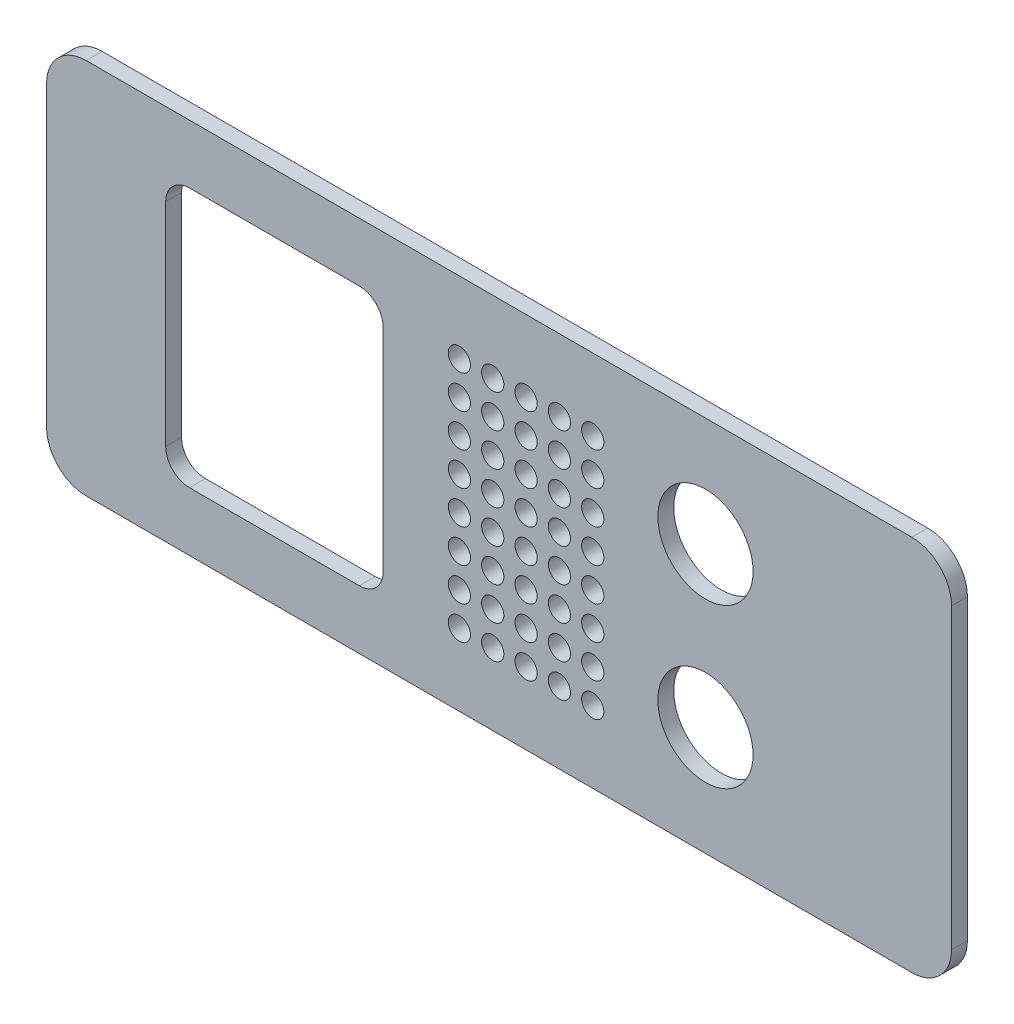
SolidWorks part; units mm, degrees
ref_plane "Front Plane" through (0, 0, 0) normal (0, 0, 1) x (1, 0, 0)
ref_plane "Top Plane" through (0, 0, 0) normal (0, 1, 0) x (1, 0, 0)
ref_plane "Right Plane" through (0, 0, 0) normal (1, 0, 0) x (0, 0, -1)
sketch "Sketch1" plane through (0, 0, 0) normal (0, 0, 1) x (1, 0, 0)
  line L0 (26, 21.275) -> (26, -20.3317) construction
  line L1 (-52, 23.75) -> (52, 23.75)
  line L2 (-57, 18.75) -> (-57, -18.75)
  line L3 (-52, -23.75) -> (52, -23.75)
  line L4 (57, 18.75) -> (57, -18.75)
  line L5 (-57, 23.75) -> (57, -23.75) construction
  line L6 (-57, -23.75) -> (57, 23.75) construction
  line L7 (-39, 16.35) -> (-17.6, 16.35)
  line L8 (-42, 13.35) -> (-42, -13.35)
  line L9 (-39, -16.35) -> (-17.6, -16.35)
  line L10 (-14.6, 13.35) -> (-14.6, -13.35)
  line L11 (-42, 16.35) -> (-14.6, -16.35) construction
  line L12 (-42, -16.35) -> (-14.6, 16.35) construction
  line L13 (-45.2, 19.4) -> (-11.4, 19.4) construction
  line L14 (-45.2, 19.4) -> (-45.2, -19.4) construction
  line L15 (-45.2, -19.4) -> (-11.4, -19.4) construction
  line L16 (-11.4, 19.4) -> (-11.4, -19.4) construction
  line L17 (-45.2, 19.4) -> (-11.4, -19.4) construction
  line L18 (-45.2, -19.4) -> (-11.4, 19.4) construction
  arc A0 (-57, -18.75) -> (-52, -23.75) centre (-52, -18.75) ccw
  arc A1 (52, -23.75) -> (57, -18.75) centre (52, -18.75) ccw
  arc A2 (52, 23.75) -> (57, 18.75) centre (52, 18.75) cw
  arc A3 (-52, 23.75) -> (-57, 18.75) centre (-52, 18.75) ccw
  circle A4 centre (-5, -14.7) radius 1.4
  circle A5 centre (-0.8, -14.7) radius 1.4
  circle A6 centre (3.4, -14.7) radius 1.4
  circle A7 centre (7.6, -14.7) radius 1.4
  circle A8 centre (11.8, -14.7) radius 1.4
  circle A9 centre (-5, -10.5) radius 1.4
  circle A10 centre (-0.8, -10.5) radius 1.4
  circle A11 centre (3.4, -10.5) radius 1.4
  circle A12 centre (7.6, -10.5) radius 1.4
  circle A13 centre (11.8, -10.5) radius 1.4
  circle A14 centre (-5, -6.3) radius 1.4
  circle A15 centre (-0.8, -6.3) radius 1.4
  circle A16 centre (3.4, -6.3) radius 1.4
  circle A17 centre (7.6, -6.3) radius 1.4
  circle A18 centre (11.8, -6.3) radius 1.4
  circle A19 centre (-5, -2.1) radius 1.4
  circle A20 centre (-0.8, -2.1) radius 1.4
  circle A21 centre (3.4, -2.1) radius 1.4
  circle A22 centre (7.6, -2.1) radius 1.4
  circle A23 centre (11.8, -2.1) radius 1.4
  circle A24 centre (-5, 2.1) radius 1.4
  circle A25 centre (-0.8, 2.1) radius 1.4
  circle A26 centre (3.4, 2.1) radius 1.4
  circle A27 centre (7.6, 2.1) radius 1.4
  circle A28 centre (11.8, 2.1) radius 1.4
  circle A29 centre (-5, 6.3) radius 1.4
  circle A30 centre (-0.8, 6.3) radius 1.4
  circle A31 centre (3.4, 6.3) radius 1.4
  circle A32 centre (7.6, 6.3) radius 1.4
  circle A33 centre (11.8, 6.3) radius 1.4
  circle A34 centre (-5, 10.5) radius 1.4
  circle A35 centre (-0.8, 10.5) radius 1.4
  circle A36 centre (3.4, 10.5) radius 1.4
  circle A37 centre (7.6, 10.5) radius 1.4
  circle A38 centre (11.8, 10.5) radius 1.4
  circle A39 centre (-5, 14.7) radius 1.4
  circle A40 centre (-0.8, 14.7) radius 1.4
  circle A41 centre (3.4, 14.7) radius 1.4
  circle A42 centre (7.6, 14.7) radius 1.4
  circle A43 centre (11.8, 14.7) radius 1.4
  arc A44 (-17.6, -16.35) -> (-14.6, -13.35) centre (-17.6, -13.35) ccw
  arc A45 (-42, -13.35) -> (-39, -16.35) centre (-39, -13.35) ccw
  arc A46 (-17.6, 16.35) -> (-14.6, 13.35) centre (-17.6, 13.35) cw
  arc A47 (-39, 16.35) -> (-42, 13.35) centre (-39, 13.35) ccw
  circle A48 centre (26, -10) radius 6
  circle A49 centre (26, 10) radius 6
  point P0 (0, 0)
  point P1 (0, 0)
  point P19 (-28.3, 0)
  point P116 (-28.3, 0)
  dimension "D3" = 5
  dimension "D7" = 52
  dimension "D11" = 3
  dimension "D14" = 31
  dimension "D15" = 20
  dimension "D1" = 114
  dimension "D2" = 47.5
  dimension "D4" = 27.4
  dimension "D5" = 32.7
  dimension "D6" = 15
  dimension "D8" = 9.05
  dimension "D12" = 33.8
  dimension "D13" = 38.8
  dimension "D9" = 5
  dimension "D10" = 8
extrude "Boss-Extrude1" add sketch "Sketch1" along normal blind 2
